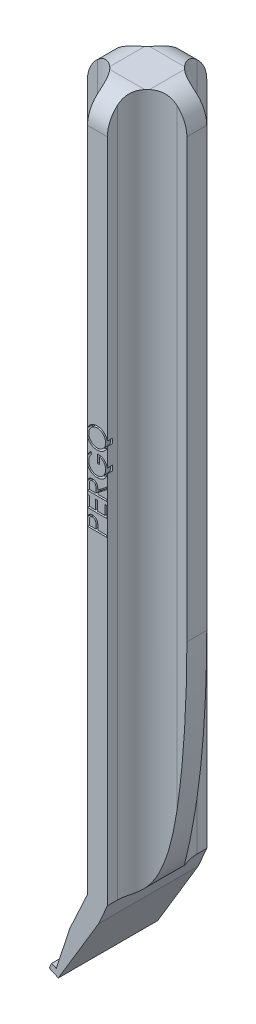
SolidWorks part; units mm, degrees
ref_plane "Front Plane" through (0, 0, 0) normal (0, 0, 1) x (1, 0, 0)
ref_plane "Top Plane" through (0, 0, 0) normal (0, 1, 0) x (1, 0, 0)
ref_plane "Right Plane" through (0, 0, 0) normal (1, 0, 0) x (0, 0, -1)
sketch "Sketch1" plane through (0, 0, 0) normal (0, 1, 0) x (1, 0, 0)
  line L1 (-1, 5) -> (1, 5)
  line L2 (-1, 5) -> (-1, -5)
  line L3 (-1, -5) -> (1, -5)
  line L4 (1, 5) -> (1, -5)
  line L5 (-1, 5) -> (1, -5) construction
  line L6 (-1, -5) -> (1, 5) construction
  point P0 (0, 0)
  dimension "D1" = 2
  dimension "D2" = 10
extrude "Boss-Extrude1" add sketch "Sketch1" along normal blind 70
sketch "Sketch2" plane through (0, 70, 0) normal (0, 1, 0) x (1, 0, 0)
  line L1 (-5, 1) -> (5, 1)
  line L2 (-5, 1) -> (-5, -1)
  line L3 (-5, -1) -> (5, -1)
  line L4 (5, 1) -> (5, -1)
  line L5 (-5, 1) -> (5, -1) construction
  line L6 (-5, -1) -> (5, 1) construction
  point P0 (0, 0)
  dimension "D1" = 2
  dimension "D2" = 10
extrude "Boss-Extrude2" add sketch "Sketch2" against normal up to surface (70 mm away)
sketch "Sketch3" plane through (0, 0, -5) normal (0, 0, -1) x (-1, 0, 0)
  line L0 (1, 0) -> (-1, 0)
  line L1 (-1, 0) -> (3.0188, -9.1569)
  line L2 (3.0188, -9.1569) -> (4.8502, -8.3532)
  line L3 (4.8502, -8.3532) -> (1, 0)
  dimension "D1" = 2
  dimension "D2" = 10
extrude "Boss-Extrude3" add sketch "Sketch3" against normal up to surface (10 mm away)
fillet "Fillet1" radius 3 4 edges at (0, 70, 5) (-5, 70, 0) (0, 70, -5) (5, 70, 0)
fillet "Fillet2" radius 23 1 edges at (-5, 0, 0)
fillet "Fillet3" radius 23 1 edges at (5, 0, 0)
sketch "Sketch5" plane through (0, 0, 5) normal (0, 0, 1) x (1, 0, 0)
  line L0 (-4.599, -7.8083) -> (-4.1449, -8.0176)
  line L2 (-1, 0) -> (-4.8502, -8.3532) construction
  line L3 (-4.1449, -8.0176) -> (-2.7706, -3.8414)
  line L4 (-2.7706, -3.8414) -> (-4.599, -7.8083)
  line L5 (-3.0188, -9.1569) -> (-3.9345, -8.7551)
  line L6 (-4.8502, -8.3532) -> (-3.0188, -9.1569) construction
  line L7 (-3.9345, -8.7551) -> (0.1334, -1.9746)
  line L8 (-3.0188, -9.1569) -> (1, 0) construction
  line L9 (0.1334, -1.9746) -> (-3.0188, -9.1569)
  dimension "D1" = 0.6
  dimension "D2" = 1
  dimension "D3" = 0.5
extrude "Cut-Extrude1" cut sketch "Sketch5" against normal blind 70
fillet "Fillet4" radius 3 4 edges
sketch "Sketch6" plane through (0, 0, 5) normal (0, 0, 1) x (1, 0, 0)
  line L0 (0.9724, 31.8161) -> (0.9724, 59.7827) construction
  text T0 "PERGO" font "Century Gothic" height 2
  point P3 (0, 0)
extrude "Cut-Extrude2" cut sketch "Sketch6" against normal blind 0.5
